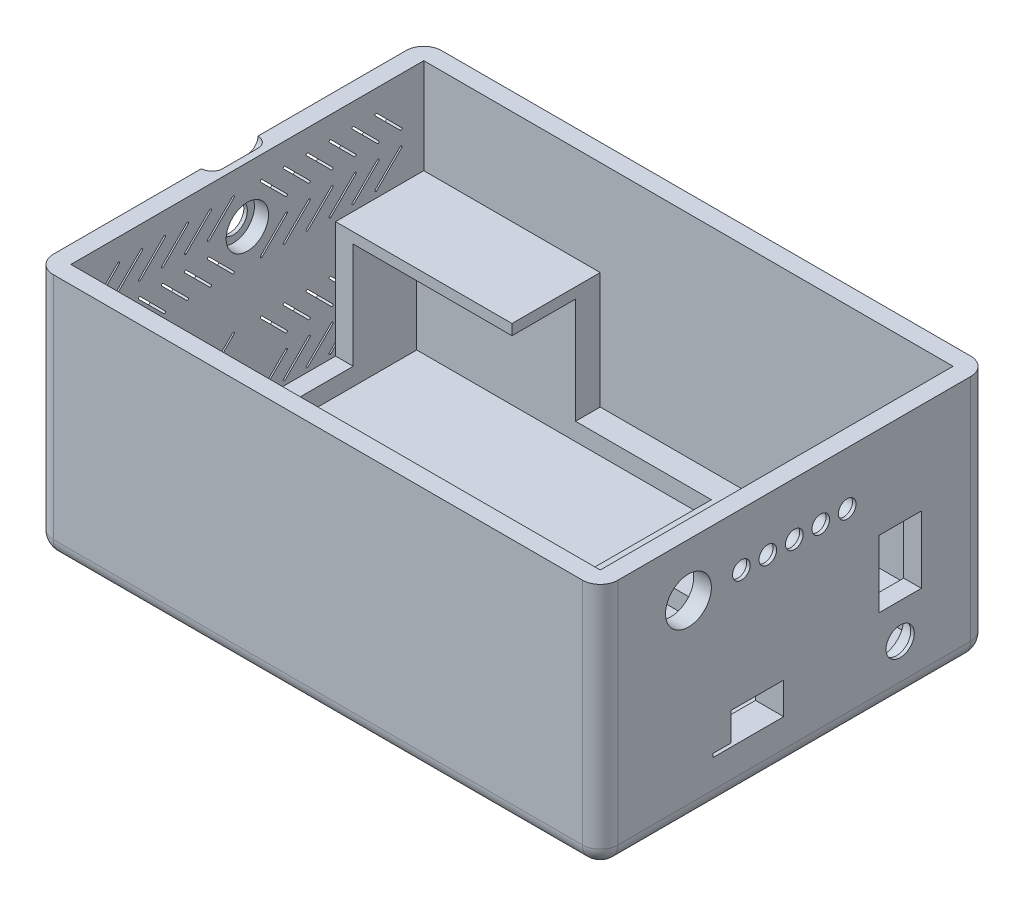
SolidWorks part; units mm, degrees
ref_plane "Front Plane" through (0, 0, 0) normal (0, 0, 1) x (1, 0, 0)
ref_plane "Top Plane" through (0, 0, 0) normal (0, 1, 0) x (1, 0, 0)
ref_plane "Right Plane" through (0, 0, 0) normal (1, 0, 0) x (0, 0, -1)
sketch "Sketch1" plane through (0, 0, 0) normal (0, 1, 0) x (1, 0, 0)
  line L1 (-75, 50) -> (75, 50)
  line L2 (-75, 50) -> (-75, -50)
  line L3 (-75, -50) -> (75, -50)
  line L4 (75, 50) -> (75, -50)
  line L5 (-75, 50) -> (75, -50) construction
  line L6 (-75, -50) -> (75, 50) construction
  point P0 (0, 0)
  dimension "D1" = 100
  dimension "D2" = 150
extrude "Boss-Extrude1" add sketch "Sketch1" along normal blind 65
shell "Shell1" thickness 5
fillet "Fillet1" radius 5 8 edges at (-80, -5, 0) (-80, 30, -55) (0, -5, -55) (80, 30, -55) (80, -5, 0) (-80, 30, 55) (80, 30, 55) (0, -5, 55)
sketch "Sketch11" plane through (0, 0, 0) normal (0, 1, 0) x (1, 0, 0)
  line L0 (75, -50) -> (75, 50) construction
  line L2 (-75, 43) -> (-70, 43)
  line L3 (-75, 50) -> (75, 50)
  line L4 (-75, 43) -> (-75, -43)
  line L5 (-75, 50) -> (-75, 43)
  line L6 (-75, -43) -> (-70, -43)
  line L7 (-70, 43) -> (-70, -43)
  line L10 (-75, 43) -> (13.5, 43)
  line L11 (75, 50) -> (75, 43)
  line L12 (75, -50) -> (75, 50) construction
  line L13 (-75, -50) -> (75, -50)
  line L14 (-75, -50) -> (-75, -43)
  line L15 (-75, -43) -> (13.5, -43)
  line L16 (75, -50) -> (75, -43)
  line L17 (18.5, 43) -> (75, 43)
  line L18 (19.9541, 50) -> (27.6949, 50)
  line L19 (13.5, 43) -> (13.5, -43)
  line L20 (19.9541, -50) -> (27.6949, -50)
  line L21 (18.5, 43) -> (18.5, 23)
  line L22 (18.5, 23) -> (75, 23)
  line L23 (13.5, 26.1512) -> (13.5, 20.6466)
  line L24 (18.5, 16) -> (75, 16)
  line L25 (75, 23) -> (75, 16)
  line L26 (18.5, -16) -> (75, -16)
  line L27 (13.5, -9.9726) -> (13.5, -17.8854)
  line L28 (18.5, -23) -> (75, -23)
  line L29 (75, -16) -> (75, -23)
  line L30 (18.5, 16) -> (18.5, -16)
  line L31 (18.5, -23) -> (18.5, -43)
  line L32 (18.5, -43) -> (75, -43)
  dimension "D1" = 7
  dimension "D2" = 7
  dimension "D3" = 7
  dimension "D4" = 20
  dimension "D5" = 20
  dimension "D6" = 7
  dimension "D7" = 5
  dimension "D8" = 56.5
  dimension "D9" = 5
extrude "Boss-Extrude4" add sketch "Sketch11" along normal blind 5 contours L32 L31 L28 L26 L30 L24 L22 L21 L17 L3 L10 L19 L15 L13 M4 M5 M6 M7
sketch "Sketch15" plane through (0, 5, 0) normal (0, 1, 0) x (1, 0, 0)
  line L0 (-70, 43) -> (13.5, 43) construction
  line L1 (-75, 50) -> (-25, 50)
  line L2 (-75, 50) -> (-75, 43)
  line L3 (-70, 43) -> (-25, 43)
  line L4 (-25, 50) -> (-25, 43)
  line L5 (-70, 43) -> (-70, -43) construction
  line L19 (-75, 43) -> (-75, 25)
  line L24 (-75, 25) -> (-70, 25)
  line L25 (-70, 43) -> (-70, 25)
  line L32 (-75, -43) -> (-75, -25)
  line L33 (-70, -43) -> (13.5, -43) construction
  line L34 (-75, -50) -> (-25, -50)
  line L35 (-75, -50) -> (-75, -43)
  line L36 (-70, -43) -> (-25, -43)
  line L37 (-25, -50) -> (-25, -43)
  line L38 (-75, -25) -> (-70, -25)
  line L39 (-70, -43) -> (-70, -25)
  dimension "D1" = 18
  dimension "D2" = 18
  dimension "D4" = 50
  dimension "D5" = 50
extrude "Boss-Extrude6" add sketch "Sketch15" along normal blind 30
sketch "Sketch17" plane through (0, 35, 0) normal (0, 1, 0) x (1, 0, 0)
  line L1 (-75, 50) -> (-25, 50)
  line L2 (-75, 50) -> (-75, 25)
  line L3 (-75, 25) -> (-25, 25)
  line L4 (-25, 50) -> (-25, 25)
  line L16 (-75, -25) -> (-25, -25)
  line L26 (-75, -25) -> (-75, -50)
  line L27 (-75, -50) -> (-25, -50)
  line L28 (-25, -25) -> (-25, -50)
  line L29 (-75, -50) -> (-25, -50) construction
  line L30 (-75, -25) -> (-75, -50) construction
  dimension "D1" = 25
  dimension "D2" = 50
  dimension "D3" = 50
  dimension "D4" = 25
extrude "Boss-Extrude7" add sketch "Sketch17" along normal blind 3
sketch "Sketch19" plane through (80, 0, 0) normal (1, 0, 0) x (0, 0, -1)
  line L0 (-50, 65) -> (-50, 0) construction
  line L1 (-18, 17) -> (-3, 17)
  line L2 (-23, 9) -> (-23, 8)
  line L3 (-23, 8) -> (-3, 8)
  line L4 (-3, 17) -> (-3, 8)
  line L5 (-18, 17) -> (-18, 9)
  line L6 (-50, 0) -> (50, 0) construction
  line L7 (-18, 9) -> (-23, 9)
  dimension "D3" = 9
  dimension "D1" = 8
  dimension "D2" = 1
  dimension "D4" = 15
  dimension "D5" = 20
  dimension "D6" = 27
extrude "Cut-Extrude1" cut sketch "Sketch19" against normal up to next
sketch "Sketch25" plane through (80, 0, 0) normal (1, 0, 0) x (0, 0, -1)
  line L0 (50, 0) -> (50, 65) construction
  line L1 (24, 39) -> (36, 39)
  line L2 (24, 39) -> (24, 20)
  line L3 (24, 20) -> (36, 20)
  line L4 (36, 39) -> (36, 20)
  line L5 (24, 39) -> (36, 20) construction
  line L6 (24, 20) -> (36, 39) construction
  line L7 (-50, 0) -> (50, 0) construction
  point P0 (30, 29.5)
  dimension "D1" = 19
  dimension "D2" = 12
  dimension "D3" = 14
  dimension "D4" = 20
extrude "Cut-Extrude2" cut sketch "Sketch25" against normal blind 5
sketch "Sketch29" plane through (75, 0, 0) normal (-1, 0, 0) x (0, 0, 1)
  line L0 (18, 17) -> (18, 9)
  line L1 (3, 8) -> (23, 8)
  line L2 (3, 8) -> (3, 17)
  line L3 (3, 17) -> (18, 17)
  line L4 (23, 8) -> (23, 9)
  line L5 (18, 9) -> (23, 9)
  dimension "D1" = 15
  dimension "D2" = 1
  dimension "D3" = 9
  dimension "D4" = 20
extrude "Extrude-Thin8" add sketch "Sketch29" along normal blind 3 thin
sketch "Sketch31" plane through (80, 0, 0) normal (1, 0, 0) x (0, 0, -1)
  line L0 (-50, 50) -> (50, 50) construction
  line L1 (50, 0) -> (50, 65) construction
  line L2 (-50, 65) -> (-50, 0) construction
  line L3 (-50, 65) -> (50, 65) construction
  circle A0 centre (0, 50) radius 2.5
  circle A1 centre (-7.5, 50) radius 2.5
  circle A2 centre (-15, 50) radius 2.5
  circle A3 centre (7.5, 50) radius 2.5
  circle A4 centre (15, 50) radius 2.5
  dimension "D2" = 5
  dimension "D6" = 7.5
  dimension "D1" = 15
  dimension "D3" = 7.5
  dimension "D4" = 7.5
  dimension "D5" = 7.5
extrude "Cut-Extrude6" cut sketch "Sketch31" against normal blind 1
sketch "Sketch33" plane through (79, 0, 0) normal (1, 0, 0) x (0, 0, -1)
  circle A0 centre (0, 50) radius 2.9
  circle A1 centre (-7.5, 50) radius 2.9
  circle A2 centre (-15, 50) radius 2.9
  circle A3 centre (7.5, 50) radius 2.9
  circle A4 centre (15, 50) radius 2.9
  dimension "D1" = 5.8
extrude "Cut-Extrude7" cut sketch "Sketch33" against normal blind 4
sketch "Sketch37" plane through (-80, 0, 0) normal (-1, 0, 0) x (0, 0, 1)
  line L1 (50, 0) -> (50, 65) construction
  line L2 (-50, 65) -> (50, 65) construction
  circle A0 centre (0, 49.25) radius 4
  dimension "D1" = 8
  dimension "D2" = 15.75
  dimension "D3" = 50
extrude "Cut-Extrude9" cut sketch "Sketch37" against normal blind 1
sketch "Sketch38" plane through (-75, 0, 0) normal (1, 0, 0) x (0, 0, -1)
  circle A0 centre (0, 49.25) radius 6
  dimension "D1" = 12
sketch "Sketch42" plane through (-80, 0, 0) normal (-1, 0, 0) x (0, 0, 1)
  line L0 (-36.4645, 58.5355) -> (-43.5355, 51.4645) construction
  line L1 (-35.7574, 57.8284) -> (-42.8284, 50.7574)
  line L2 (-37.1716, 59.2426) -> (-44.2426, 52.1716)
  line L3 (-50, 65) -> (-50, 0) construction
  line L4 (-50, 65) -> (50, 65) construction
  arc A0 (-35.7574, 57.8284) -> (-37.1716, 59.2426) centre (-36.4645, 58.5355) ccw
  arc A1 (-44.2426, 52.1716) -> (-42.8284, 50.7574) centre (-43.5355, 51.4645) ccw
  point P2 (-40, 55)
  dimension "D2" = 1
  dimension "D1" = 10
  dimension "D3" = 45
  dimension "D4" = 10
  dimension "D5" = 10
extrude "Cut-Extrude10" cut sketch "Sketch42" against normal blind 5 draft 8
pattern_linear "LPattern1" count 6 spacing 6.5 along (0, 0, 1) of "Cut-Extrude10"
mirror "Mirror1" about plane through (0, 0, 0) normal (0, 0, 1) of "LPattern1", "Cut-Extrude10"
sketch "Sketch45" plane through (-80, 0, 0) normal (-1, 0, 0) x (0, 0, 1)
  line L0 (-50, 49.25) -> (50, 49.25) construction
  line L1 (-50, 65) -> (-50, 0) construction
  line L2 (50, 0) -> (50, 65) construction
  line L3 (-50, 65) -> (50, 65) construction
  dimension "D1" = 15.75
ref_plane "Plane1" through (0, 49.25, 0) normal (0, -1, 0) x (0, 0, 1)
mirror "Mirror2" about plane through (0, 49.25, 0) normal (0, -1, 0) of "Mirror1", "LPattern1", "Cut-Extrude10"
sketch "Sketch46" plane through (-80, 0, 0) normal (-1, 0, 0) x (0, 0, 1)
  line L0 (-50, 32.5) -> (50, 32.5) construction
  line L1 (-50, 65) -> (-50, 0) construction
  line L2 (50, 0) -> (50, 65) construction
ref_plane "Plane2" through (0, 32.5, 0) normal (0, -1, 0) x (0, 0, 1)
mirror "Mirror3" about plane through (0, 32.5, 0) normal (0, -1, 0) of "Mirror2", "Cut-Extrude10", "LPattern1", "Mirror1"
sketch "Sketch47" plane through (-80, 0, 0) normal (-1, 0, 0) x (0, 0, 1)
  line L0 (-5, 65) -> (5, 65)
  line L1 (-50, 65) -> (50, 65) construction
  line L2 (-8, 65) -> (-5, 65)
  line L3 (5, 65) -> (8, 65)
  line L4 (-5, 62) -> (5, 62)
  arc A0 (8, 65) -> (5, 62) centre (5, 65) cw
  arc A1 (-8, 65) -> (-5, 62) centre (-5, 65) ccw
  point P8 (0, 65)
  dimension "D1" = 3
  dimension "D2" = 3
  dimension "D3" = 10
revolve "Cut-Revolve1" cut sketch "Sketch47" angle 90 about L0
sketch "Sketch48" plane through (80, 0, 0) normal (1, 0, 0) x (0, 0, -1)
  line L1 (-50, 0) -> (50, 0) construction
  line L2 (50, 0) -> (50, 65) construction
  circle A0 centre (30, 10) radius 4
  dimension "D1" = 8
  dimension "D2" = 10
  dimension "D3" = 20
extrude "Cut-Extrude14" cut sketch "Sketch48" against normal blind 1
sketch "Sketch49" plane through (75, 0, 0) normal (-1, 0, 0) x (0, 0, 1)
  circle A0 centre (-30, 10) radius 6
  dimension "D1" = 12
sketch "Sketch52" plane through (80, 0, 0) normal (1, 0, 0) x (0, 0, -1)
  line L0 (-50, 65) -> (50, 65) construction
  line L1 (-50, 65) -> (-50, 0) construction
  circle A0 centre (-30, 50) radius 6.5
  dimension "D1" = 13
  dimension "D2" = 15
  dimension "D3" = 20
extrude "Cut-Extrude15" cut sketch "Sketch52" against normal blind 5
extrude "Cut-Extrude16" cut sketch "Sketch49" against normal blind 4
extrude "Cut-Extrude17" cut sketch "Sketch38" against normal blind 4
